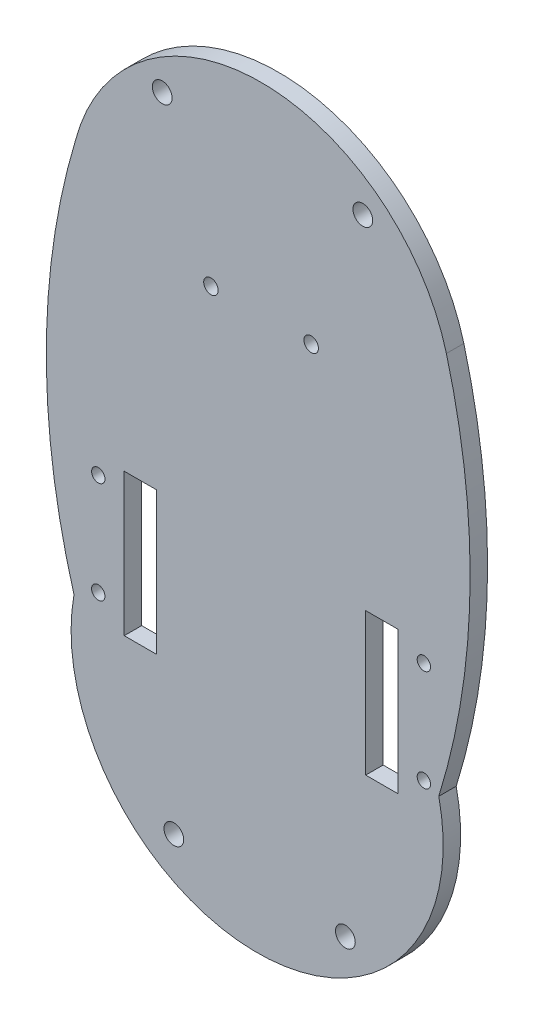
SolidWorks part; units mm, degrees
ref_plane "Alzado" through (0, 0, 0) normal (0, 0, 1) x (1, 0, 0)
ref_plane "Planta" through (0, 0, 0) normal (0, 1, 0) x (1, 0, 0)
ref_plane "Vista lateral" through (0, 0, 0) normal (1, 0, 0) x (0, 0, -1)
sketch "Sketch1" plane through (0, 0, 0) normal (0, 0, 1) x (1, 0, 0)
  line L0 (0, 0) -> (0, -130) construction
  arc A16 (-31.877, -24.4644) -> (31.877, -24.4644) centre (0, -33) cw
  arc A17 (-32.1793, -92.4) -> (30.5663, -91.0774) centre (-0.6744, -98.0071) ccw
  arc A18 (-31.877, -24.4644) -> (-32.1793, -92.4) centre (83.0627, -58.9443) ccw
  arc A19 (31.877, -24.4644) -> (30.5663, -91.0774) centre (-84.0394, -55.5029) cw
  circle A20 centre (17.5, -11) radius 1.7
  circle A21 centre (14.5, -120) radius 1.7
  circle A22 centre (28, -72.54) radius 1.15
  circle A23 centre (28, -90) radius 1.15
  circle A25 centre (-28, -90) radius 1.15
  circle A26 centre (-28, -72.54) radius 1.15
  circle A28 centre (-15, -119.5) radius 1.7
  circle A29 centre (-17, -10) radius 1.7
  point P5 (0, -130)
  dimension "D1" = 130
  dimension "D2" = 33
  dimension "D3" = 32
  dimension "D4" = 120
  dimension "D9" = 17.5
  dimension "D10" = 11
  dimension "D14" = 2.3
  dimension "D17" = 28
  dimension "D5" = 120
  dimension "D8" = 3.4
  dimension "D11" = 3.4
  dimension "D15" = 28
  dimension "2.6" = 2.3
  dimension "D19" = 3.4
  dimension "D22" = 3.4
  dimension "D6" = 37.6
  dimension "D7" = 91.0774
  dimension "D12" = 14.5
  dimension "D13" = 10
  dimension "D16" = 17.46
  dimension "D18" = 40
  dimension "D20" = 10.5
  dimension "D21" = 15
  dimension "D23" = 10
  dimension "D24" = 17
extrude "Boss-Extrude1" add sketch "Sketch1" along normal blind 3
sketch "Sketch2" plane through (0, 0, 3) normal (0, 0, 1) x (1, 0, 0)
  line L1 (-23.5341, -69.7076) -> (-18, -69.7076)
  line L2 (-23.5341, -69.7076) -> (-23.5341, -94.2076)
  line L3 (-23.5341, -94.2076) -> (-18, -94.2076)
  line L4 (-18, -69.7076) -> (-18, -94.2076)
  line L5 (-23.5341, -69.7076) -> (-18, -94.2076) construction
  line L6 (-23.5341, -94.2076) -> (-18, -69.7076) construction
  line L7 (18, -69.7076) -> (23.53, -69.7076)
  line L8 (18, -69.7076) -> (18, -94.2076)
  line L9 (18, -94.2076) -> (23.53, -94.2076)
  line L10 (23.53, -69.7076) -> (23.53, -94.2076)
  line L11 (18, -69.7076) -> (23.53, -94.2076) construction
  line L12 (18, -94.2076) -> (23.53, -69.7076) construction
  point P0 (-20.7671, -81.9576)
  point P7 (20.765, -81.9576)
  dimension "D1" = 18
  dimension "D2" = 18
  dimension "D3" = 69.7076
  dimension "D4" = 69.7076
  dimension "D5" = 5.5341
  dimension "D6" = 5.53
  dimension "D7" = 24.5
  dimension "D8" = 24.5
extrude "Cut-Extrude1" cut sketch "Sketch2" against normal blind 10
sketch "Sketch3" plane through (0, 0, 3) normal (0, 0, 1) x (1, 0, 0)
  line L0 (-18, -69.7076) -> (-23.5341, -69.7076) construction
  circle A0 centre (-8.62, -34.7076) radius 1.25
  circle A1 centre (8.62, -34.7076) radius 1.25
  point P4 (0, 0)
  point P5 (0, 0)
  point P6 (0, 0)
  point P9 (0, 0)
  point P14 (-68.2461, 16.2928)
  dimension "D1" = 2.5
  dimension "D2" = 2.5
  dimension "D3" = 17.24
  dimension "D4" = 35
  dimension "D5" = 8.62
extrude "Cut-Extrude2" cut sketch "Sketch3" against normal blind 10
